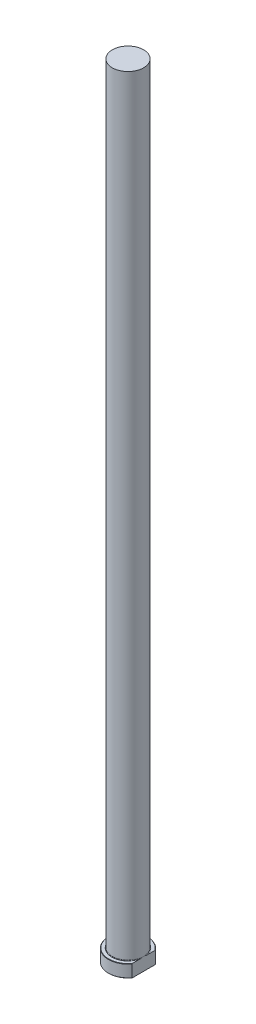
SolidWorks part; units mm, degrees
ref_plane "Front Plane" through (0, 0, 0) normal (0, 0, 1) x (1, 0, 0)
ref_plane "Top Plane" through (0, 0, 0) normal (0, 1, 0) x (1, 0, 0)
ref_plane "Right Plane" through (0, 0, 0) normal (1, 0, 0) x (0, 0, -1)
sketch "Sketch1" plane through (0, 0, 0) normal (0, 0, 1) x (1, 0, 0)
  line L0 (0, 259.9588) -> (0, -15.1925) construction
  line L1 (0, 0) -> (-12.5, 0)
  line L2 (-12.5, 0) -> (-12.5, 8)
  line L3 (-12.5, 8) -> (-10, 8)
  line L4 (-10, 8) -> (-10, 500)
  line L5 (-10, 500) -> (0, 500)
  line L6 (0, 500) -> (0, 0)
  dimension "L" = 500
  dimension "H" = 25
  dimension "T" = 8
  dimension "D" = 20
revolve "Revolve1" add sketch "Sketch1" angle 360 about L0
chamfer "Chamfer1" distance 0.2 angle 45 2 edges at (0, 8, 12.5) (0, 0, 12.5)
fillet "Fillet1" radius 0.3 1 edges at (0, 8, 10)
sketch "Sketch2" plane through (0, 0, 0) normal (0, 1, 0) x (1, 0, 0)
  line L0 (10, -7.5) -> (10, 7.5)
  circle A0 centre (0, 0) radius 12.5 construction
  arc A1 (10, -7.5) -> (10, 7.5) centre (0, 0) ccw
  circle A2 centre (0, 0) radius 10 construction
extrude "KEYED HEAD" cut sketch "Sketch2" along normal through all
